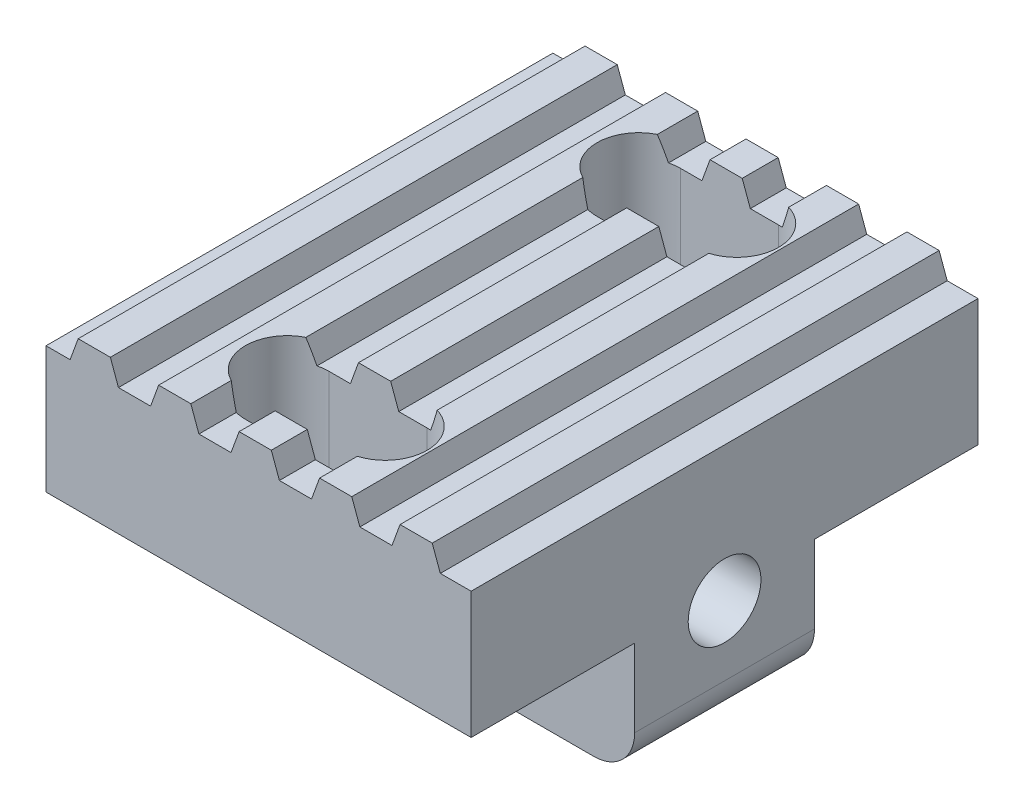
SolidWorks part; units mm, degrees
ref_plane "Front" through (0, 0, 0) normal (0, 0, 1) x (1, 0, 0)
ref_plane "Top" through (0, 0, 0) normal (0, 1, 0) x (1, 0, 0)
ref_plane "Right" through (0, 0, 0) normal (1, 0, 0) x (0, 0, -1)
sketch "Sketch1" plane through (0, 0, 0) normal (0, 0, 1) x (1, 0, 0)
  line L0 (0.7452, -0.0102) -> (1, 0.6898)
  line L1 (1, 0.6898) -> (2, 0.6898)
  line L2 (2, 0.6898) -> (2.2548, -0.0102)
  line L3 (0.7452, -0.0102) -> (2.2548, -0.0102)
  point P2 (1.5, 0.6898)
  dimension "D1" = 110
  dimension "D2" = 110
  dimension "D3" = 1
  dimension "D4" = 0.7
  dimension "D5" = 1.5
extrude "Extrude1" add sketch "Sketch1" along normal blind 15.748
sketch "Sketch2" plane through (0, 0, 0) normal (0, 1, 0) x (1, 0, 0)
  line L0 (2, -15.748) -> (1, -15.748) construction
  line L1 (0, 0) -> (13.208, 0)
  line L2 (0, 0) -> (0, -15.748)
  line L3 (0, -15.748) -> (13.208, -15.748)
  line L4 (13.208, 0) -> (13.208, -15.748)
  dimension "D1" = 13.208
extrude "Extrude2" add sketch "Sketch2" against normal blind 7.62
pattern_linear "LPattern1" count 5 spacing 2.5 along (1, 0, 0) of "Extrude1"
hole_wizard "#10-32 Tapped Hole1" positions "Sketch4" profile "Sketch3" tap size "#10-32" standard "Ansi Inch"
sketch "Sketch4" plane through (0, 0, 0) normal (-1, 0, 0) x (0, 0, 1)
  line L0 (0, 0) -> (24.638, 0) construction
  line L1 (0, -3.556) -> (0, 0) construction
  point P0 (17.78, 0.508)
  dimension "D1" = 0.508
  dimension "D2" = 17.78
sketch "Sketch3" plane through (0, 0.508, 17.78) normal (0, 1, 0) x (0, 0, 1)
  line L0 (0, 0) -> (0, 13.208)
  line L1 (0, 13.208) -> (2.0193, 13.208)
  line L2 (2.0193, 13.208) -> (2.0193, 0)
  line L5 (2.0193, 0) -> (0, 0)
  line L11 (0, -6.35) -> (0, 107.95) construction
  dimension "Thru Tap Drill Dia." = 4.0386
  dimension "Thru Tap Drill Depth" = 13.208
sketch "Sketch7" plane through (0, -7.62, 0) normal (0, -1, 0) x (1, 0, 0)
  line L1 (8.128, 2.413) -> (5.08, 2.413) construction
  line L3 (13.208, 0) -> (0, 0) construction
  line L5 (13.208, 15.748) -> (13.208, 0) construction
  line L6 (0, 0) -> (0, 15.748) construction
  line L7 (8.128, 3.7084) -> (5.08, 3.7084)
  line L8 (8.128, 1.1176) -> (5.08, 1.1176)
  arc A0 (8.128, 1.1176) -> (8.128, 3.7084) centre (8.128, 2.413) ccw
  arc A1 (5.08, 3.7084) -> (5.08, 1.1176) centre (5.08, 2.413) ccw
  dimension "D2" = 2.5908
  dimension "D3" = 5.08
  dimension "D4" = 5.08
  dimension "D5" = 3.048
  dimension "D1" = 2.413
extrude "Cut-Extrude1" cut sketch "Sketch7" against normal through all
ref_plane "center" through (0, 0, 7.874) normal (0, 0, 1) x (1, 0, 0)
mirror "Mirror1" about plane through (0, 0, 7.874) normal (0, 0, 1) of "Cut-Extrude1"
hole_wizard "#43 (0.089) Diameter Hole1" positions "Sketch10" profile "Sketch9" hole size "#43" standard "Ansi Inch"
sketch "Sketch10" plane through (0, 0, 0) normal (-1, 0, 0) x (0, 0, 1)
  line L0 (7.874, -4.5704) -> (7.874, 4.5704) construction
  line L2 (0, 0) -> (15.748, 0) construction
  point P0 (7.874, -4.191)
  dimension "D1" = 4.191
sketch "Sketch9" plane through (0, -4.191, 7.874) normal (0, 1, 0) x (0, 0, 1)
  line L0 (0, 0) -> (0, 13.208)
  line L1 (0, 13.208) -> (1.1303, 13.208)
  line L2 (1.1303, 13.208) -> (1.1303, 0)
  line L5 (1.1303, 0) -> (0, 0)
  line L11 (0, -6.35) -> (0, 107.95) construction
  dimension "Thru Hole Dia." = 2.2606
  dimension "Thru Hole Depth" = 13.208
sketch "Sketch11" plane through (0, 0, 0) normal (-1, 0, 0) x (0, 0, 1)
  line L1 (0, -7.62) -> (5.08, -7.62)
  line L2 (0, -7.62) -> (0, -3.937)
  line L3 (0, -3.937) -> (5.08, -3.937)
  line L4 (5.08, -7.62) -> (5.08, -3.937)
  dimension "D1" = 5.08
  dimension "D2" = 3.683
extrude "Cut-Extrude2" cut sketch "Sketch11" against normal through all
mirror "Mirror2" about plane through (0, 0, 7.874) normal (0, 0, 1) of "Cut-Extrude2"
ref_plane "Plane1" through (6.35, 0, 0) normal (1, 0, 0) x (0, 0, -1)
fillet "Fillet1" radius 1.27 1 edges at (13.208, -7.62, 7.874)
